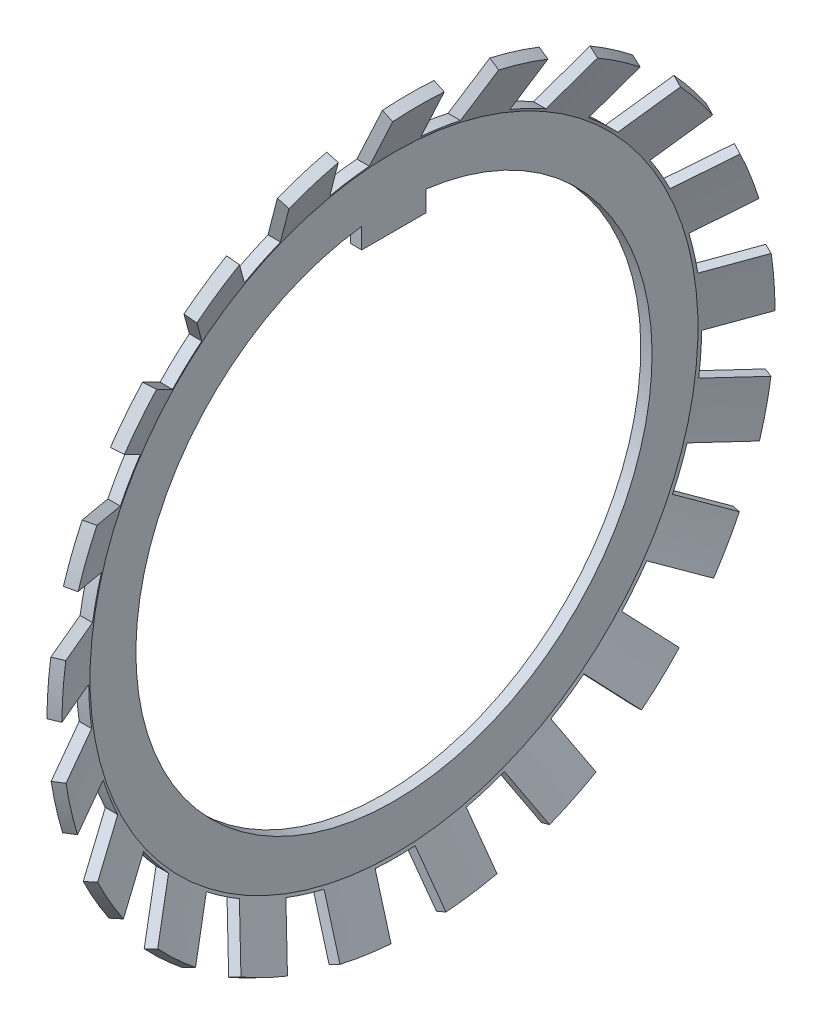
SolidWorks part; units mm, degrees
ref_plane "Plan de face" through (0, 0, 0) normal (0, 0, 1) x (1, 0, 0)
ref_plane "Plan de dessus" through (0, 0, 0) normal (0, 1, 0) x (1, 0, 0)
ref_plane "Plan de droite" through (0, 0, 0) normal (1, 0, 0) x (0, 0, -1)
sketch "Esquisse1" plane through (0, 0, 0) normal (0, 0, 1) x (1, 0, 0)
  line L0 (0, 0) -> (0, 47.5)
  line L1 (0, 47.5) -> (3.9636, 56)
  line L2 (3.9636, 56) -> (5.5497, 55.2604)
  line L3 (5.5497, 55.2604) -> (1.75, 47.112)
  line L4 (1.75, 47.112) -> (1.75, 0)
  line L5 (1.75, 0) -> (0, 0)
  line L6 (1.75, 0) -> (0, 0) construction
revolve "Révolution1" add sketch "Esquisse1" angle 360 about L6
sketch "Esquisse2" plane through (0, 0, 0) normal (1, 0, 0) x (0, 0, -1)
  line L0 (5, 39.6863) -> (5, 36.5)
  line L1 (5, 36.5) -> (-5, 36.5)
  line L2 (-5, 36.5) -> (-5, 39.6863)
  arc A0 (-5, 39.6863) -> (5, 39.6863) centre (0, 0) ccw
extrude "Enlèv. mat.-Extru.1" cut sketch "Esquisse2" along normal blind 1.75
sketch "Esquisse3" plane through (0, 0, 0) normal (1, 0, 0) x (0, 0, -1)
  line L0 (-123.2, 123.2) -> (-123.2, -123.2)
  line L1 (-123.2, -123.2) -> (123.2, -123.2)
  line L2 (123.2, -123.2) -> (123.2, 123.2)
  line L3 (123.2, 123.2) -> (-123.2, 123.2)
  line L4 (-55.9997, 0.1854) -> (-47.4979, -0.4517)
  line L5 (-47.0347, -6.6325) -> (-55.3466, -8.5296)
  line L6 (-53.5664, -16.3291) -> (-45.2545, -14.4319)
  line L7 (-42.9901, -20.2015) -> (-50.3735, -24.4644)
  line L8 (-46.3735, -31.3926) -> (-38.9901, -27.1297)
  line L9 (-35.1257, -31.9756) -> (-40.9246, -38.2254)
  line L10 (-35.0602, -43.6667) -> (-29.2612, -37.417)
  line L11 (-24.1401, -40.9085) -> (-27.8393, -48.5898)
  line L12 (-20.6316, -52.0609) -> (-16.9324, -44.3795)
  line L13 (-11.0097, -46.2065) -> (-12.2804, -54.6369)
  line L14 (-4.3697, -55.8293) -> (-3.099, -47.3988)
  line L15 (3.099, -47.3988) -> (4.3697, -55.8293)
  line L16 (12.2804, -54.6369) -> (11.0097, -46.2065)
  line L17 (16.9324, -44.3795) -> (20.6316, -52.0609)
  line L18 (27.8393, -48.5898) -> (24.1401, -40.9085)
  line L19 (29.2612, -37.417) -> (35.0602, -43.6667)
  line L20 (40.9246, -38.2254) -> (35.1257, -31.9756)
  line L21 (38.9901, -27.1297) -> (46.3735, -31.3926)
  line L22 (50.3735, -24.4644) -> (42.9901, -20.2015)
  line L23 (45.2545, -14.4319) -> (53.5664, -16.3291)
  line L24 (55.3466, -8.5296) -> (47.0347, -6.6325)
  line L25 (47.4979, -0.4517) -> (55.9997, 0.1854)
  line L26 (55.4019, 8.163) -> (46.9, 7.5259)
  line L27 (45.5208, 13.5686) -> (53.4571, 16.6833)
  line L28 (50.5344, 24.1303) -> (42.5981, 21.0156)
  line L29 (39.499, 26.3832) -> (46.1647, 31.6989)
  line L30 (41.1768, 37.9536) -> (34.5111, 32.6379)
  line L31 (29.9676, 36.8537) -> (34.7703, 43.8979)
  line L32 (28.1604, 48.4045) -> (23.3577, 41.3602)
  line L33 (17.7734, 44.0495) -> (20.2864, 52.1964)
  line L34 (12.6418, 54.5544) -> (10.1288, 46.4075)
  line L35 (4, 47.3313) -> (4, 55.857)
  line L36 (-4, 55.857) -> (-4, 47.3313)
  line L37 (-10.1288, 46.4075) -> (-12.6418, 54.5544)
  line L38 (-20.2864, 52.1964) -> (-17.7734, 44.0495)
  line L39 (-23.3577, 41.3602) -> (-28.1604, 48.4045)
  line L40 (-34.7703, 43.8979) -> (-29.9676, 36.8537)
  line L41 (-34.5111, 32.6379) -> (-41.1768, 37.9536)
  line L42 (-46.1647, 31.6989) -> (-39.499, 26.3832)
  line L43 (-42.5981, 21.0156) -> (-50.5344, 24.1303)
  line L44 (-53.4571, 16.6833) -> (-45.5208, 13.5686)
  line L45 (-46.9, 7.5259) -> (-55.4019, 8.163)
  arc A0 (-47.4979, -0.4517) -> (-47.0347, -6.6325) centre (0, 0) ccw
  arc A1 (-55.3466, -8.5296) -> (-53.5664, -16.3291) centre (0, 0) ccw
  arc A2 (-45.2545, -14.4319) -> (-42.9901, -20.2015) centre (0, 0) ccw
  arc A3 (-50.3735, -24.4644) -> (-46.3735, -31.3926) centre (0, 0) ccw
  arc A4 (-38.9901, -27.1297) -> (-35.1257, -31.9756) centre (0, 0) ccw
  arc A5 (-40.9246, -38.2254) -> (-35.0602, -43.6667) centre (0, 0) ccw
  arc A6 (-29.2612, -37.417) -> (-24.1401, -40.9085) centre (0, 0) ccw
  arc A7 (-27.8393, -48.5898) -> (-20.6316, -52.0609) centre (0, 0) ccw
  arc A8 (-16.9324, -44.3795) -> (-11.0097, -46.2065) centre (0, 0) ccw
  arc A9 (-12.2804, -54.6369) -> (-4.3697, -55.8293) centre (0, 0) ccw
  arc A10 (-3.099, -47.3988) -> (3.099, -47.3988) centre (0, 0) ccw
  arc A11 (4.3697, -55.8293) -> (12.2804, -54.6369) centre (0, 0) ccw
  arc A12 (11.0097, -46.2065) -> (16.9324, -44.3795) centre (0, 0) ccw
  arc A13 (20.6316, -52.0609) -> (27.8393, -48.5898) centre (0, 0) ccw
  arc A14 (24.1401, -40.9085) -> (29.2612, -37.417) centre (0, 0) ccw
  arc A15 (35.0602, -43.6667) -> (40.9246, -38.2254) centre (0, 0) ccw
  arc A16 (35.1257, -31.9756) -> (38.9901, -27.1297) centre (0, 0) ccw
  arc A17 (46.3735, -31.3926) -> (50.3735, -24.4644) centre (0, 0) ccw
  arc A18 (42.9901, -20.2015) -> (45.2545, -14.4319) centre (0, 0) ccw
  arc A19 (53.5664, -16.3291) -> (55.3466, -8.5296) centre (0, 0) ccw
  arc A20 (47.0347, -6.6325) -> (47.4979, -0.4517) centre (0, 0) ccw
  arc A21 (55.9997, 0.1854) -> (55.4019, 8.163) centre (0, 0) ccw
  arc A22 (46.9, 7.5259) -> (45.5208, 13.5686) centre (0, 0) ccw
  arc A23 (53.4571, 16.6833) -> (50.5344, 24.1303) centre (0, 0) ccw
  arc A24 (42.5981, 21.0156) -> (39.499, 26.3832) centre (0, 0) ccw
  arc A25 (46.1647, 31.6989) -> (41.1768, 37.9536) centre (0, 0) ccw
  arc A26 (34.5111, 32.6379) -> (29.9676, 36.8537) centre (0, 0) ccw
  arc A27 (34.7703, 43.8979) -> (28.1604, 48.4045) centre (0, 0) ccw
  arc A28 (23.3577, 41.3602) -> (17.7734, 44.0495) centre (0, 0) ccw
  arc A29 (20.2864, 52.1964) -> (12.6418, 54.5544) centre (0, 0) ccw
  arc A30 (10.1288, 46.4075) -> (4, 47.3313) centre (0, 0) ccw
  arc A31 (4, 55.857) -> (-4, 55.857) centre (0, 0) ccw
  arc A32 (-4, 47.3313) -> (-10.1288, 46.4075) centre (0, 0) ccw
  arc A33 (-12.6418, 54.5544) -> (-20.2864, 52.1964) centre (0, 0) ccw
  arc A34 (-17.7734, 44.0495) -> (-23.3577, 41.3602) centre (0, 0) ccw
  arc A35 (-28.1604, 48.4045) -> (-34.7703, 43.8979) centre (0, 0) ccw
  arc A36 (-29.9676, 36.8537) -> (-34.5111, 32.6379) centre (0, 0) ccw
  arc A37 (-41.1768, 37.9536) -> (-46.1647, 31.6989) centre (0, 0) ccw
  arc A38 (-39.499, 26.3832) -> (-42.5981, 21.0156) centre (0, 0) ccw
  arc A39 (-50.5344, 24.1303) -> (-53.4571, 16.6833) centre (0, 0) ccw
  arc A40 (-45.5208, 13.5686) -> (-46.9, 7.5259) centre (0, 0) ccw
  arc A41 (-55.4019, 8.163) -> (-55.9997, 0.1854) centre (0, 0) ccw
extrude "Enlèv. mat.-Extru.2" cut sketch "Esquisse3" along normal blind 76.5
sketch "Esquisse4" plane through (1.75, 0, 0) normal (1, 0, 0) x (0, 0, -1)
  line L1 (-67.9908, 0) -> (75.975, 0)
  line L2 (-67.9908, 0) -> (-67.9908, -74.3532)
  line L3 (-67.9908, -74.3532) -> (75.975, -74.3532)
  line L4 (75.975, 0) -> (75.975, -74.3532)
extrude "Enlèv. mat.-Extru.3" [suppressed] cut sketch "Esquisse4" against normal mid plane 90
